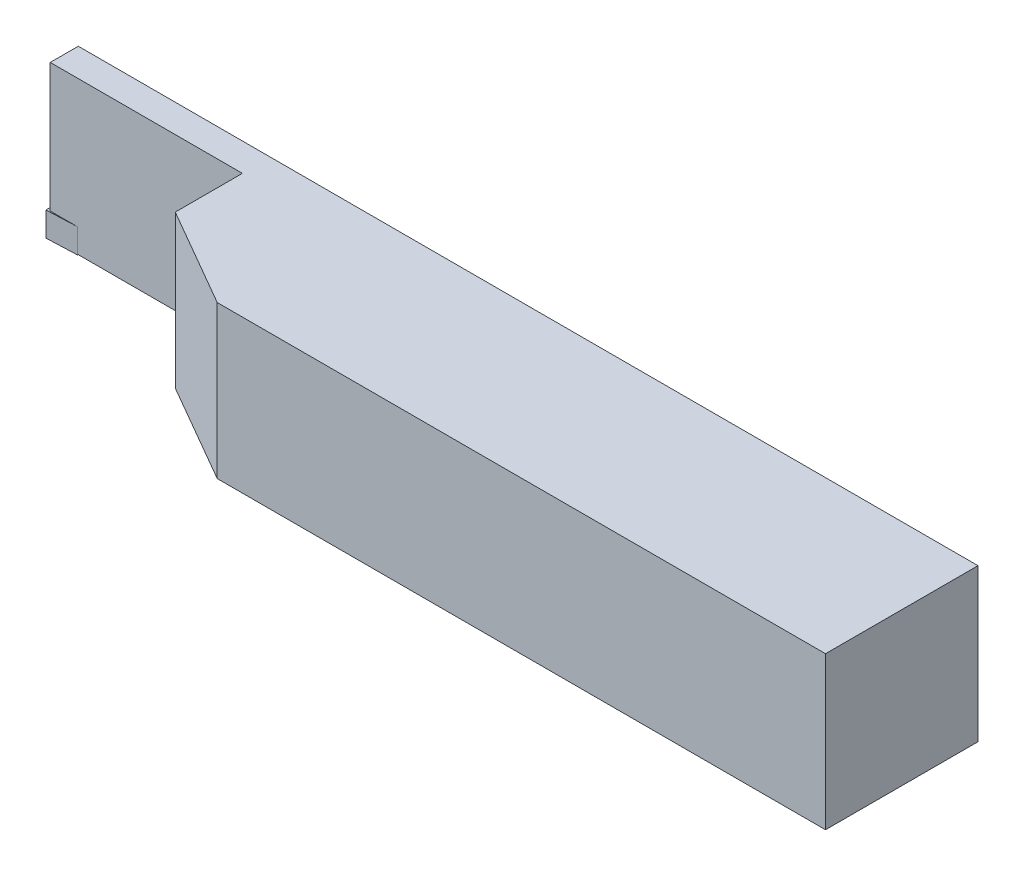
SolidWorks part; units mm, degrees
ref_plane "Plan1" through (0, 0, 0) normal (0, 0, 1) x (1, 0, 0)
ref_plane "Plan2" through (0, 0, 0) normal (0, 1, 0) x (1, 0, 0)
ref_plane "Plan3" through (0, 0, 0) normal (1, 0, 0) x (0, 0, -1)
sketch "EsqPlaquette" plane through (0, 0, 0) normal (0, 1, 0) x (1, 0, 0)
  line L0 (0, -0.0104) -> (0, -4.9896)
  line L1 (0.0104, -0.0004) -> (4.9904, -0.1996)
  line L2 (5, -0.2096) -> (5, -4.7904)
  line L3 (4.9904, -4.8004) -> (0.0104, -4.9996)
  arc A0 (0.0104, -0.0004) -> (0, -0.0104) centre (0.01, -0.0104) ccw
  arc A1 (0.0104, -4.9996) -> (0, -4.9896) centre (0.01, -4.9896) cw
  arc A2 (5, -4.7904) -> (4.9904, -4.8004) centre (4.99, -4.7904) cw
  arc A3 (4.9904, -0.1996) -> (5, -0.2096) centre (4.99, -0.2096) cw
  point P7 (0, 0)
  point P10 (0, -5)
  point P13 (5, -4.8)
  point P16 (5, -0.2)
  dimension "RBec" = 0.01
  dimension "D2" = 5
  dimension "D3" = 0.2
  dimension "D4" = 4.6
  dimension "la" = 5
extrude "Plaquette" add sketch "EsqPlaquette" along normal blind 4
ref_plane "Plan4" through (0, 0.1, 0) normal (0, 1, 0) x (-1, 0, 0)
sketch "EsqCorps" plane through (0, 0.1, 0) normal (0, 1, 0) x (-1, 0, 0)
  line L0 (-0.5, 0.2) -> (-148, 0.2)
  line L2 (-0.5, 4.8) -> (-32, 4.8)
  line L3 (-32, 4.8) -> (-32, 15.8)
  line L4 (-32, 15.8) -> (-48.2813, 25.2)
  line L5 (-48.2813, 25.2) -> (-148, 25.2)
  line L6 (-148, 25.2) -> (-148, 0.2)
  line L7 (-0.5, 0.2) -> (-0.5, 4.8)
  dimension "D1" = 25
  dimension "D2" = 0.5
  dimension "D3" = 4.6
  dimension "D4" = 0.2
  dimension "D5" = 11
  dimension "D6" = 60
  dimension "D7" = 32
  dimension "D8" = 116
extrude "CorpsOutil" add sketch "EsqCorps" along normal blind 25
